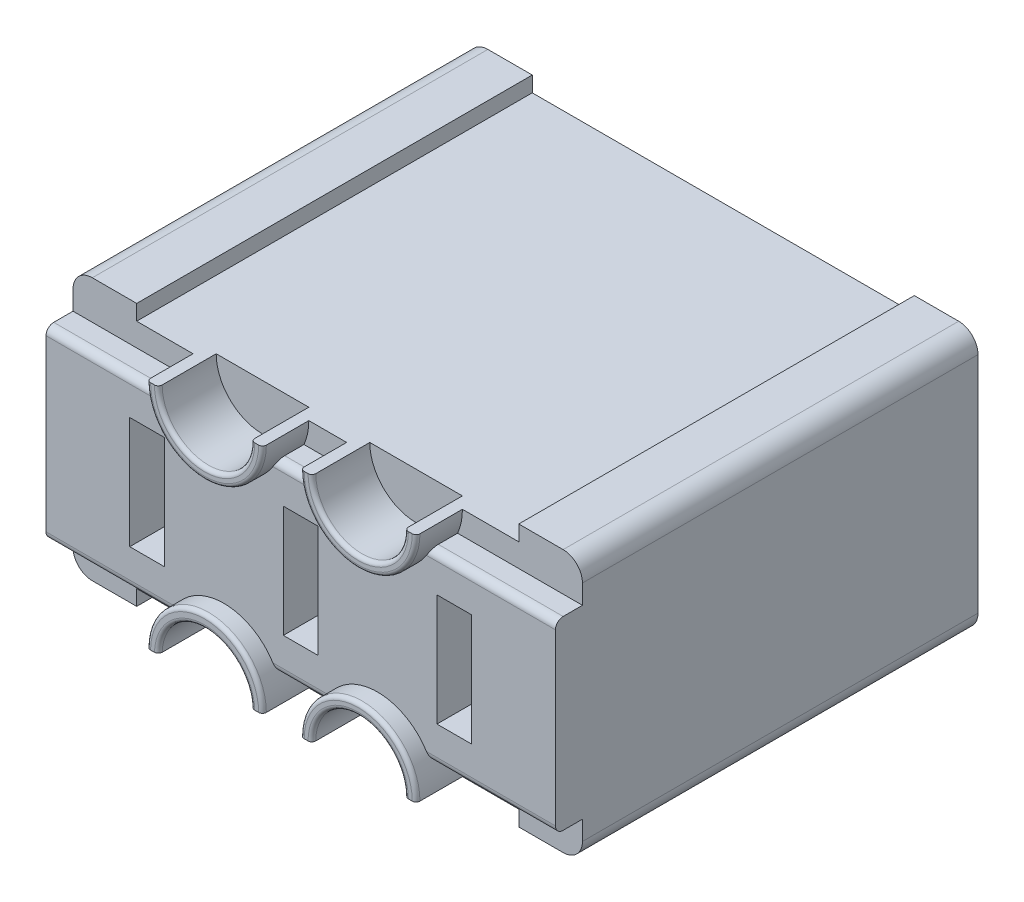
SolidWorks part; units mm, degrees
ref_plane "Plan de face" through (0, 0, 0) normal (0, 0, 1) x (1, 0, 0)
ref_plane "Plan de dessus" through (0, 0, 0) normal (0, 1, 0) x (1, 0, 0)
ref_plane "Plan de droite" through (0, 0, 0) normal (1, 0, 0) x (0, 0, -1)
sketch "Esquisse1" plane through (0, 0, 0) normal (0, 0, 1) x (1, 0, 0)
  line L1 (0, 0) -> (13.2, 0)
  line L2 (0, 0) -> (0, 6.8)
  line L3 (0, 6.8) -> (13.2, 6.8)
  line L4 (13.2, 0) -> (13.2, 6.8)
  dimension "D1" = 13.2
  dimension "D2" = 6.8
extrude "Boss.-Extru.1" add sketch "Esquisse1" against normal blind 11.45
sketch "Esquisse2" plane through (0, 0, 0) normal (0, 0, 1) x (1, 0, 0)
  line L0 (13.2, 6.8) -> (0, 6.8) construction
  line L1 (1.65, 6.8) -> (11.55, 6.8)
  line L2 (1.65, 6.8) -> (1.65, 6.4)
  line L3 (1.65, 6.4) -> (11.55, 6.4)
  line L4 (11.55, 6.8) -> (11.55, 6.4)
  line L5 (0, 0) -> (13.2, 0) construction
  line L6 (1.65, 0) -> (11.55, 0)
  line L7 (1.65, 0) -> (1.65, 0.4)
  line L8 (1.65, 0.4) -> (11.55, 0.4)
  line L9 (11.55, 0) -> (11.55, 0.4)
  line L10 (0, 6.8) -> (0, 0) construction
  dimension "D1" = 9.9
  dimension "D2" = 9.9
  dimension "D3" = 0.4
  dimension "D4" = 0.4
  dimension "D5" = 1.65
  dimension "D6" = 1.65
extrude "Enlèv. mat.-Extru.1" cut sketch "Esquisse2" against normal through all
sketch "Esquisse4" plane through (0, 0, 0) normal (0, 0, 1) x (1, 0, 0)
  line L0 (4.61, 8.0272) -> (4.61, -0.3354) construction
  line L1 (8.59, 8.0272) -> (8.59, -0.7448) construction
  line L2 (1.65, 6.4) -> (11.55, 6.4) construction
  line L3 (11.55, 0.4) -> (1.65, 0.4) construction
  line L4 (1.65, 6.8) -> (1.65, 6.4) construction
  line L5 (11.55, 6.4) -> (11.55, 6.8) construction
  line L6 (3.11, 6.4) -> (1.65, 6.4)
  line L7 (1.65, 6.4) -> (1.65, 6.8)
  line L8 (1.65, 6.8) -> (0, 6.8) construction
  line L9 (1.65, 6.8) -> (0, 6.8)
  line L10 (0, 6.8) -> (0, 0)
  line L11 (0, 0) -> (1.65, 0)
  line L12 (1.65, 0) -> (1.65, 0.4)
  line L13 (1.65, 0.4) -> (3.11, 0.4)
  line L14 (6.11, 0.4) -> (7.09, 0.4)
  line L15 (10.09, 0.4) -> (11.55, 0.4)
  line L16 (11.55, 0) -> (11.55, 0.4) construction
  line L17 (11.55, 0.4) -> (11.55, 0)
  line L18 (11.55, 0) -> (13.2, 0)
  line L19 (13.2, 0) -> (13.2, 6.8)
  line L20 (13.2, 6.8) -> (11.55, 6.8) construction
  line L21 (13.2, 0) -> (13.2, 6.8) construction
  line L22 (13.2, 6.8) -> (11.55, 6.8)
  line L23 (11.55, 6.8) -> (11.55, 6.4)
  line L24 (11.55, 6.4) -> (10.09, 6.4)
  line L25 (7.09, 6.4) -> (6.11, 6.4)
  arc A0 (3.11, 6.4) -> (6.11, 6.4) centre (4.61, 6.4) ccw
  arc A1 (7.09, 6.4) -> (10.09, 6.4) centre (8.59, 6.4) ccw
  arc A2 (6.11, 0.4) -> (3.11, 0.4) centre (4.61, 0.4) ccw
  arc A3 (10.09, 0.4) -> (7.09, 0.4) centre (8.59, 0.4) ccw
  point P20 (1.65, 6.6)
  dimension "D1" = 1.5
  dimension "D2" = 1.5
  dimension "D3" = 1.5
  dimension "D4" = 1.5
  dimension "D5" = 2.96
  dimension "D6" = 2.96
extrude "Enlèv. mat.-Extru.4" cut sketch "Esquisse4" against normal blind 0.5
sketch "Esquisse5" plane through (0, 0, 0) normal (0, 0, 1) x (1, 0, 0)
  line L0 (4.61, 7.3401) -> (4.61, -0.3939) construction
  line L1 (8.59, 7.3401) -> (8.59, -0.774) construction
  line L2 (1.65, 6.4) -> (1.65, 6.8) construction
  line L3 (11.55, 6.8) -> (11.55, 6.4) construction
  line L4 (3.11, 6.4) -> (6.11, 6.4) construction
  line L5 (7.09, 6.4) -> (10.09, 6.4) construction
  line L6 (6.11, 0.4) -> (3.11, 0.4) construction
  line L7 (10.09, 0.4) -> (7.09, 0.4) construction
  line L8 (3.41, 6.4) -> (5.81, 6.4)
  line L9 (7.39, 6.4) -> (9.79, 6.4)
  line L10 (3.4105, 0.4) -> (5.8095, 0.4)
  line L11 (7.39, 0.4) -> (9.79, 0.4)
  arc A0 (3.41, 6.4) -> (5.81, 6.4) centre (4.61, 6.4) ccw
  arc A1 (9.79, 6.4) -> (7.39, 6.4) centre (8.59, 6.4) cw
  arc A2 (5.8095, 0.4) -> (3.4105, 0.4) centre (4.61, 0.3663) ccw
  arc A3 (9.79, 0.4) -> (7.39, 0.4) centre (8.59, 0.4) ccw
  point P4 (1.65, 6.6)
  point P7 (11.55, 6.6)
  dimension "D3" = 1.2
  dimension "D4" = 1.2
  dimension "D5" = 1.2
  dimension "D6" = 1.2
  dimension "D1" = 2.96
  dimension "D2" = 2.96
extrude "Enlèv. mat.-Extru.5" cut sketch "Esquisse5" against normal blind 1.5
sketch "Esquisse6" plane through (0, 0, -0.5) normal (0, 0, 1) x (1, 0, 0)
  line L0 (4.61, 8.0711) -> (4.61, -1.0664) construction
  line L1 (8.59, 8.0711) -> (8.59, -1.0664) construction
  line L2 (1.65, 6.4) -> (1.65, 6.8) construction
  line L3 (11.55, 6.8) -> (11.55, 6.4) construction
  line L4 (5.81, 6.4) -> (3.41, 6.4) construction
  line L5 (1.8168, 5.8) -> (14.0433, 5.8) construction
  line L6 (3.11, 6.4) -> (1.65, 6.4) construction
  line L7 (3.11, 6.4) -> (1.65, 6.4)
  line L8 (1.65, 6.4) -> (1.65, 6.8)
  line L9 (1.65, 6.8) -> (0, 6.8)
  line L10 (0, 6.8) -> (0, 5.8)
  line L11 (0, 6.8) -> (0, 0) construction
  line L12 (0, 5.8) -> (3.2352, 5.8)
  line L13 (9.79, 6.4) -> (7.39, 6.4) construction
  line L14 (10.09, 6.4) -> (11.55, 6.4)
  line L15 (11.55, 6.4) -> (11.55, 6.8)
  line L16 (11.55, 6.8) -> (13.2, 6.8)
  line L17 (13.2, 6.8) -> (13.2, 5.8)
  line L18 (13.2, 0) -> (13.2, 6.8) construction
  line L19 (13.2, 5.8) -> (9.9648, 5.8)
  line L20 (7.09, 6.4) -> (6.11, 6.4) construction
  line L21 (6.11, 6.4) -> (7.09, 6.4)
  line L22 (5.9848, 5.8) -> (7.2152, 5.8)
  line L23 (-0.2493, 1) -> (14.1078, 1) construction
  line L24 (1.65, 0.4) -> (3.11, 0.4) construction
  line L25 (3.2352, 1) -> (0, 1)
  line L26 (0, 1) -> (0, 0)
  line L27 (0, 0) -> (1.65, 0)
  line L28 (1.65, 0) -> (1.65, 0.4)
  line L29 (1.65, 0.4) -> (3.11, 0.4)
  line L30 (6.11, 0.4) -> (5.8095, 0.4) construction
  line L31 (7.39, 0.4) -> (9.79, 0.4) construction
  line L32 (5.9848, 1) -> (7.2152, 1)
  line L33 (6.11, 0.4) -> (7.09, 0.4)
  line L34 (7.09, 0.4) -> (7.0787, 0.397)
  line L35 (9.9648, 1) -> (13.2, 1)
  line L36 (13.2, 1) -> (13.2, 0)
  line L37 (13.2, 0) -> (11.55, 0)
  line L38 (11.55, 0) -> (11.55, 0.4)
  line L39 (11.55, 0.4) -> (10.09, 0.4)
  arc A0 (3.11, 6.4) -> (3.2352, 5.8) centre (4.61, 6.4) ccw
  arc A2 (10.09, 6.4) -> (9.9648, 5.8) centre (8.59, 6.4) cw
  arc A3 (7.09, 6.4) -> (7.2152, 5.8) centre (8.59, 6.4) ccw
  arc A4 (7.09, 6.4) -> (10.09, 6.4) centre (8.59, 6.4) ccw construction
  arc A5 (7.09, 6.4) -> (10.09, 6.4) centre (8.59, 6.4) ccw construction
  arc A6 (6.11, 6.4) -> (5.9848, 5.8) centre (4.61, 6.4) cw
  arc A7 (3.11, 6.4) -> (6.11, 6.4) centre (4.61, 6.4) ccw construction
  arc A8 (3.11, 0.4) -> (3.2352, 1) centre (4.61, 0.4) cw
  arc A9 (5.9848, 1) -> (6.11, 0.4) centre (4.61, 0.4) cw
  arc A10 (7.2152, 1) -> (7.09, 0.4) centre (8.59, 0.4) ccw
  arc A11 (10.09, 0.4) -> (7.09, 0.4) centre (8.59, 0.4) ccw construction
  arc A12 (9.9648, 1) -> (10.09, 0.4) centre (8.59, 0.4) cw
  arc A13 (10.09, 0.4) -> (7.09, 0.4) centre (8.59, 0.4) ccw construction
  point P6 (11.55, 6.6)
  dimension "D4" = 0.6
  dimension "D5" = 1.5
  dimension "D6" = 1.5
  dimension "D1" = 2.96
  dimension "D2" = 2.96
  dimension "D3" = 0.6
extrude "Enlèv. mat.-Extru.7" cut sketch "Esquisse6" against normal blind 0.7 contours L12 M11 M7 M8 M9 M10 | L22 M7 M25 M26 | L19 M21 M22 M23 M24 M25 | L35 M17 M18 M19 M20 M21 | L32 M15 M16 M17 | L25 M15 M11 M12 M13 M14
fillet "Congé2" radius 0.5 4 edges at (13.2, 0, -6.325) (13.2, 6.8, -6.325) (0, 0, -6.325) (0, 6.8, -6.325)
fillet "Congé3" radius 0.1 8 edges at (4.61, 1.5663, 0) (4.61, 1.9, 0) (8.59, 1.9, 0) (8.59, 1.6, 0) (8.59, 4.9, 0) (8.59, 5.2, 0) (4.61, 5.2, 0) (4.61, 4.9, 0)
fillet "Congé4" radius 0.2 6 edges at (1.6176, 1, -0.5) (6.6, 1, -0.5) (11.5824, 1, -0.5) (11.5824, 5.8, -0.5) (6.6, 5.8, -0.5) (1.6176, 5.8, -0.5)
sketch "Esquisse7" plane through (0, 0, -0.5) normal (0, 0, 1) x (1, 0, 0)
  line L0 (-1.3241, 3.4) -> (15.0069, 3.4) construction
  line L1 (0.5, 0) -> (1.65, 0) construction
  line L2 (4.61, 7.8372) -> (4.61, -0.2778) construction
  line L3 (2.17, 4.85) -> (3.07, 4.85)
  line L4 (2.17, 4.85) -> (2.17, 1.95)
  line L5 (2.17, 1.95) -> (3.07, 1.95)
  line L6 (3.07, 4.85) -> (3.07, 1.95)
  line L7 (6.15, 4.85) -> (7.05, 4.85)
  line L8 (6.15, 4.85) -> (6.15, 1.95)
  line L9 (6.15, 1.95) -> (7.05, 1.95)
  line L10 (7.05, 4.85) -> (7.05, 1.95)
  line L11 (10.13, 4.85) -> (11.03, 4.85)
  line L12 (10.13, 4.85) -> (10.13, 1.95)
  line L13 (10.13, 1.95) -> (11.03, 1.95)
  line L14 (11.03, 4.85) -> (11.03, 1.95)
  line L15 (8.59, 7.8372) -> (8.59, -0.8625) construction
  line L16 (1.65, 6.4) -> (1.65, 6.8) construction
  line L17 (11.55, 6.8) -> (11.55, 6.4) construction
  dimension "D1" = 3.4
  dimension "D2" = 1.45
  dimension "D3" = 1.45
  dimension "D4" = 1.45
  dimension "D5" = 0.9
  dimension "D6" = 0.9
  dimension "D7" = 0.9
  dimension "D8" = 2.9
  dimension "D9" = 2.9
  dimension "D10" = 2.9
  dimension "D11" = 2.96
  dimension "D12" = 2.96
  dimension "D13" = 1.54
  dimension "D14" = 1.54
  dimension "D15" = 1.54
extrude "Enlèv. mat.-Extru.8" cut sketch "Esquisse7" against normal through all
sketch "Esquisse8" plane through (0, 0, -11.45) normal (0, 0, -1) x (-1, 0, 0)
  line L0 (-13.2, 0.5) -> (-13.2, 6.3) construction
  line L1 (-11.55, 5.6) -> (-1.65, 5.6)
  line L2 (-11.55, 5.6) -> (-11.55, 1.2)
  line L3 (-11.55, 1.2) -> (-1.65, 1.2)
  line L4 (-1.65, 5.6) -> (-1.65, 1.2)
  line L5 (0, 6.3) -> (0, 0.5) construction
  line L6 (-1.65, 6.4) -> (-11.55, 6.4) construction
  line L7 (-11.55, 0.4) -> (-1.65, 0.4) construction
  dimension "D1" = 1.65
  dimension "D2" = 1.65
  dimension "D3" = 0.8
  dimension "D4" = 0.8
extrude "Enlèv. mat.-Extru.9" cut sketch "Esquisse8" against normal blind 0.5
